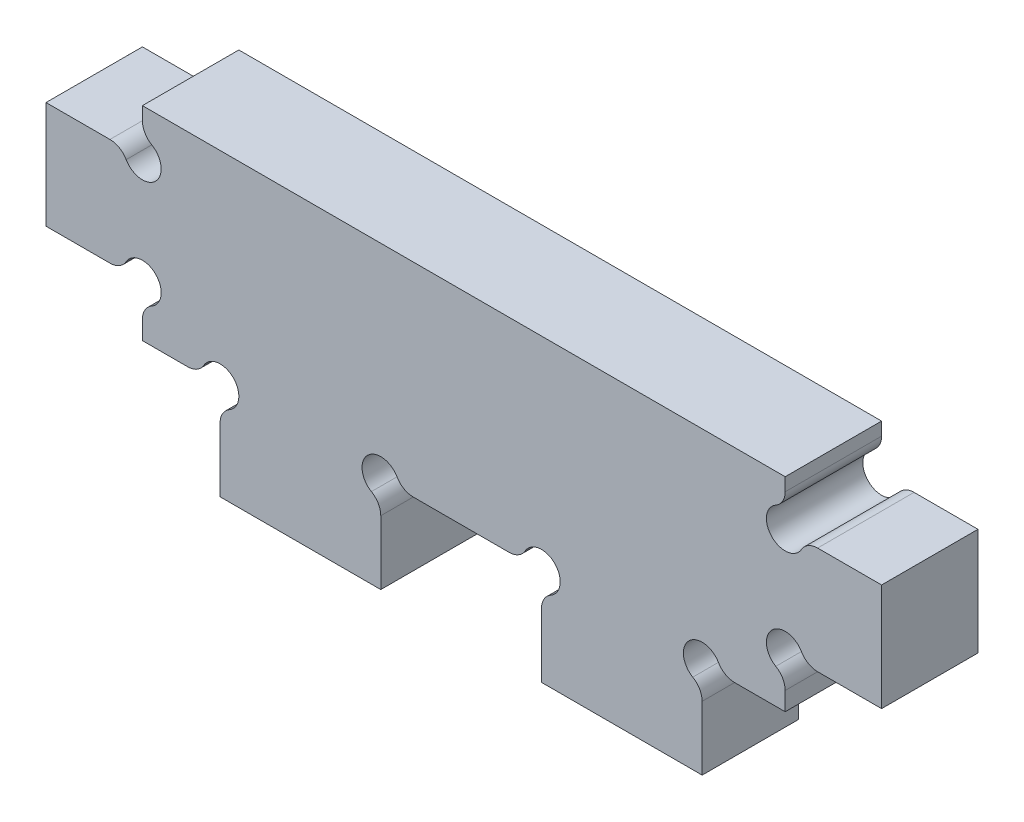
SolidWorks part; units mm, degrees
ref_plane "Front Plane" through (0, 0, 0) normal (0, 0, 1) x (1, 0, 0)
ref_plane "Top Plane" through (0, 0, 0) normal (0, 1, 0) x (1, 0, 0)
ref_plane "Right Plane" through (0, 0, 0) normal (1, 0, 0) x (0, 0, -1)
sketch "Sketch1" plane through (0, 0, 0) normal (0, 0, 1) x (1, 0, 0)
  line L0 (0, 0) -> (99.3876, 0) construction
  line L1 (-59.5, 18.5) -> (60.5, 18.5)
  line L2 (-59.5, 11.6583) -> (-59.5, 18.5)
  line L3 (-59.5, -19.5) -> (60.5, -19.5)
  line L4 (60.5, -13) -> (60.5, -19.5)
  line L5 (78.5, -10) -> (63.5, -10)
  line L6 (-59.5, -13) -> (-59.5, -19.5)
  line L7 (78.5, -10) -> (78.5, 10)
  line L8 (-77.5, -10) -> (-62.5, -10)
  line L9 (-77.5, -10) -> (-77.5, 10)
  line L10 (-77.5, 10) -> (-60, 10)
  line L11 (0.5, -0.5) -> (0.5, 65.4672) construction
  line L12 (-77.5, -10) -> (-60, 0) construction
  line L13 (-77.5, 10) -> (-60, 0) construction
  line L14 (78.5, 10) -> (61, 10)
  line L15 (60.5, 11.6583) -> (60.5, 18.5)
  line L16 (-59.5, 11.6583) -> (-59.5, 10)
  line L17 (-59.5, 10) -> (-60, 10)
  line L18 (-62.5, -10) -> (-59.5, -10)
  line L19 (-59.5, -13) -> (-59.5, -10)
  line L20 (60.5, -13) -> (60.5, -10)
  line L21 (60.5, -10) -> (63.5, -10)
  line L22 (60.5, 11.6583) -> (60.5, 10)
  line L23 (60.5, 10) -> (61, 10)
  point P0 (0, 0)
  point P7 (-60, 0)
  point P21 (0.5, -19.5)
  point P23 (-77.5, 0)
  point P31 (0.5, 18.5)
  dimension "D5" = 18
  dimension "D3" = 18
  dimension "D1" = 60
  dimension "D2" = 38
  dimension "D4" = 20
extrude "Boss-Extrude1" add sketch "Sketch1" along normal blind 18
sketch "Sketch3" plane through (0, 0, 18) normal (0, 0, 1) x (1, 0, 0)
  line L0 (-59.5, -19.5) -> (60.5, -19.5) construction
  line L1 (-45, -1.5) -> (-15, -1.5)
  line L2 (-45, -1.5) -> (-45, -37.5)
  line L3 (-45, -37.5) -> (-15, -37.5)
  line L4 (-15, -1.5) -> (-15, -37.5)
  line L5 (-45, -1.5) -> (-15, -37.5) construction
  line L6 (-45, -37.5) -> (-15, -1.5) construction
  line L7 (0, 0) -> (0, 54.0706) construction
  line L8 (45, -1.5) -> (15, -1.5)
  line L9 (15, -1.5) -> (15, -37.5)
  line L10 (45, -1.5) -> (45, -37.5)
  line L11 (45, -37.5) -> (15, -37.5)
  point P0 (-30, -19.5)
  dimension "D1" = 30
  dimension "D2" = 30
  dimension "D3" = 18
extrude "Boss-Extrude3" add sketch "Sketch3" against normal up to surface (18 mm away)
sketch "Sketch4" plane through (0, 0, 18) normal (0, 0, 1) x (1, 0, 0)
  circle A0 centre (-45, -19.5) radius 3.5
  circle A1 centre (-15, -19.5) radius 3.5
  circle A2 centre (15, -19.5) radius 3.5
  circle A3 centre (45, -19.5) radius 3.5
  circle A4 centre (-59.5, 10) radius 3.5
  circle A5 centre (-59.5, -10) radius 3.5
  circle A6 centre (60.5, 10) radius 3.5
  circle A7 centre (60.5, -10) radius 3.5
  dimension "D1" = 7
extrude "Cut-Extrude1" cut sketch "Sketch4" against normal through all both and the other way through all
fillet "Fillet1" radius 3.5 16 edges at (48.5, -19.5, 9) (45, -23, 9) (15, -23, 9) (11.5, -19.5, 9) (-11.5, -19.5, 9) (-15, -23, 9) (-45, -23, 9) (-48.5, -19.5, 9) (64, -10, 9) (60.5, -13.5, 9) (64, 10, 9) (60.5, 13.5, 9) (-59.5, 13.5, 9) (-63, 10, 9) (-63, -10, 9) (-59.5, -13.5, 9)
